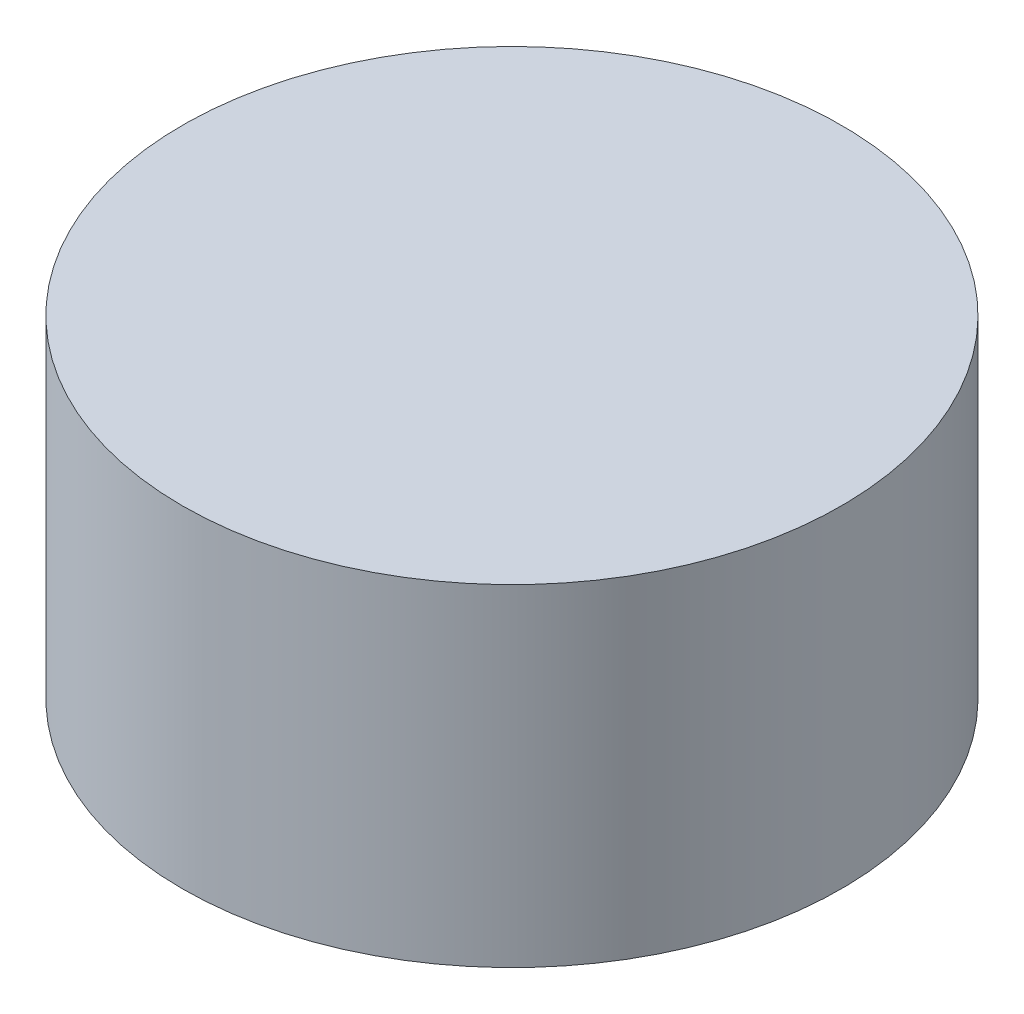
SolidWorks part; units mm, degrees
ref_plane "Front Plane" through (0, 0, 0) normal (0, 0, 1) x (1, 0, 0)
ref_plane "Top Plane" through (0, 0, 0) normal (0, 1, 0) x (1, 0, 0)
ref_plane "Right Plane" through (0, 0, 0) normal (1, 0, 0) x (0, 0, -1)
sketch "Sketch1" plane through (0, 0, 0) normal (0, 1, 0) x (1, 0, 0)
  circle A0 centre (0, 0) radius 1.9939
  dimension "D1" = 3.9878
extrude "Boss-Extrude1" add sketch "Sketch1" along normal blind 2.0066
